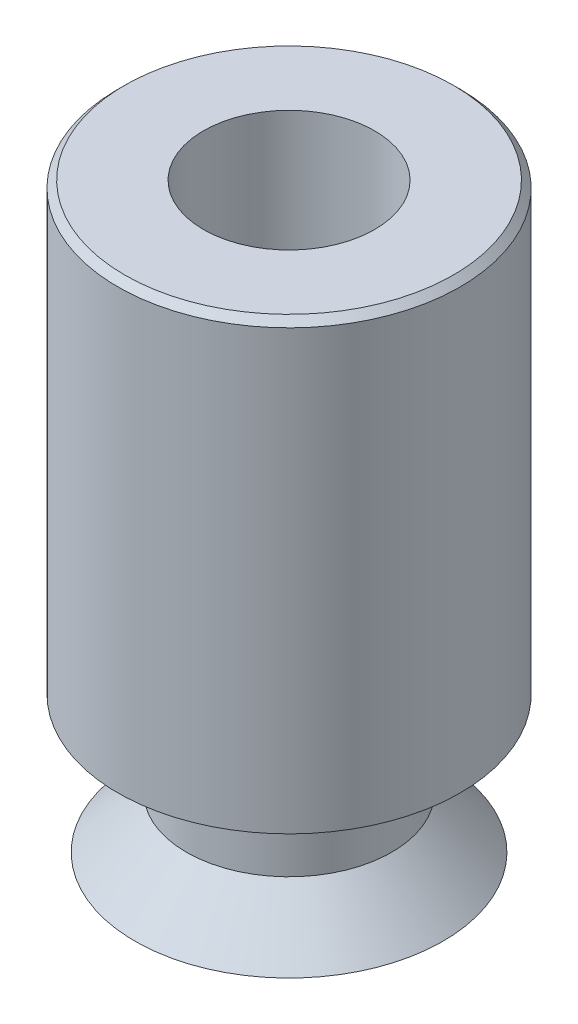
SolidWorks part; units mm, degrees
ref_plane "Face" through (0, 0, 0) normal (0, 0, 1) x (1, 0, 0)
ref_plane "Dessus" through (0, 0, 0) normal (0, 1, 0) x (1, 0, 0)
ref_plane "Droite" through (0, 0, 0) normal (1, 0, 0) x (0, 0, -1)
sketch "Esquisse1" plane through (0, 0, 0) normal (0, 0, 1) x (1, 0, 0)
  line L0 (0, 17) -> (-5, 17)
  line L1 (-5, 17) -> (-5, 4)
  line L2 (-5, 4) -> (-3, 4)
  line L3 (-3, 4) -> (-3, 1.5)
  line L4 (-3, 1.5) -> (-4.5, 0)
  line L5 (-4.5, 0) -> (0, 0)
  line L6 (0, 0) -> (0, 17)
  line L7 (0, 0) -> (0, 27.3201) construction
  line L8 (-12.0775, 4) -> (12.0775, 4) construction
  line L10 (-12.0775, 0) -> (12.0775, 0) construction
  line L11 (-12.0775, 4) -> (-15.201, 4) construction
  line L12 (-3, 4) -> (-3, 1.5) construction
  dimension "D1" = 10
  dimension "D2" = 4.5
  dimension "D3" = 1.5
  dimension "D4" = 13
revolve "Révolution1" add sketch "Esquisse1" angle 360 about L7
hole_wizard "Trou taraudé M6x1.01" positions "Esquisse3" profile "Esquisse2" tap size "M6x1.0" standard "ISO"
sketch "Esquisse3" plane through (0, 17, 0) normal (0, 1, 0) x (-1, 0, 0)
  circle A0 centre (0, 0) radius 5 construction
  point P0 (0, 0)
sketch "Esquisse2" plane through (0, 17, 0) normal (1, 0, 0) x (0, 0, 1)
  line L0 (0, 0) -> (0, 14.4434)
  line L1 (0, 14.4434) -> (2.5, 13)
  line L2 (2.5, 13) -> (2.5, 0)
  line L5 (2.5, 0) -> (0, 0)
  line L10 (0, 14.4434) -> (-2.5, 13) construction
  line L11 (0, -6.35) -> (0, 107.95) construction
  dimension "Diamètre du trou pour taraudage" = 5
  dimension "Profondeur du trou pour taraudage" = 13
  dimension "Angle de pointe" = 120
chamfer "Chanfrein1" distance 0.2 angle 45
